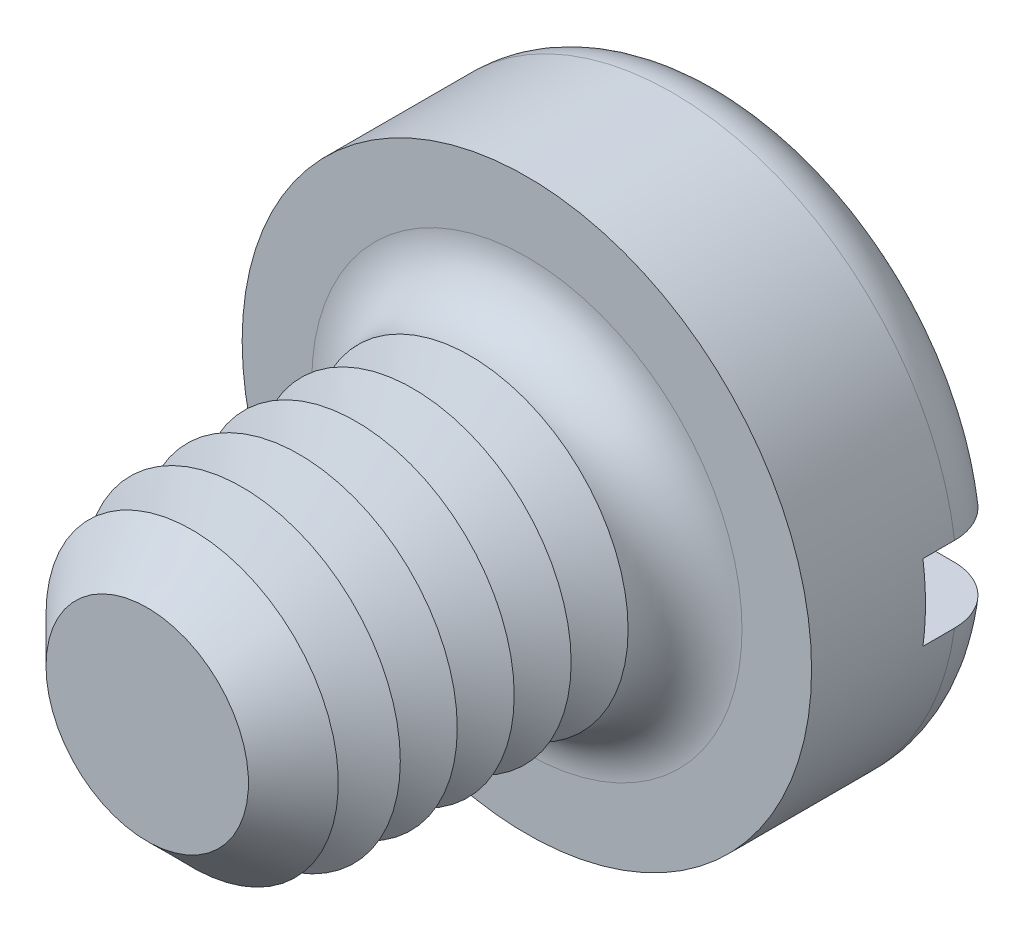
SolidWorks part; units mm, degrees
ref_plane "Front Plane" through (0, 0, 0) normal (0, 0, 1) x (1, 0, 0)
ref_plane "Top Plane" through (0, 0, 0) normal (0, 1, 0) x (1, 0, 0)
ref_plane "Right Plane" through (0, 0, 0) normal (1, 0, 0) x (0, 0, -1)
sketch "Sketch3" plane through (0, 0, 0) normal (0, 0, 1) x (1, 0, 0)
  circle A0 centre (0, 0) radius 2.25
  dimension "D1" = 4.5
extrude "Boss-Extrude2" add sketch "Sketch3" against normal blind 1.6
sketch "Sketch4" plane through (0, 0, 0) normal (0, 0, 1) x (1, 0, 0)
  circle A0 centre (0, 0) radius 1.25
  dimension "D1" = 2.5
extrude "Boss-Extrude3" add sketch "Sketch4" along normal blind 3
fillet "Fillet1" radius 0.45 2 edges at (2.25, 0, -1.6) (1.25, 0, 0)
chamfer "Chamfer1" distance 0.45 angle 45 1 edges at (1.25, 0, 3)
sketch "Sketch5" plane through (0, 0, 0) normal (1, 0, 0) x (0, 0, -1)
  line L0 (1.6944, 0) -> (-7.6738, 0) construction
sketch "Sketch6" plane through (0, 0, 0) normal (1, 0, 0) x (0, 0, -1)
  line L0 (-0.45, 1.25) -> (-0.675, 0.8603)
  line L1 (-0.675, 0.8603) -> (-0.9, 1.25)
  line L2 (-0.45, 1.25) -> (-2.55, 1.25) construction
  line L3 (-0.9, 1.25) -> (-0.45, 1.25)
  dimension "D1" = 0.45
revolve "Cut-Revolve1" cut sketch "Sketch6" angle 360 about L0
pattern_linear "LPattern1" count 5 spacing 0.45 along (0, 0, 1) of "Cut-Revolve1"
sketch "Sketch8" plane through (0, 0, -1.6) normal (0, 0, -1) x (-1, 0, 0)
  line L1 (2.25, -0.3) -> (-2.25, -0.3)
  line L2 (2.25, -0.3) -> (2.25, 0.3)
  line L3 (2.25, 0.3) -> (-2.25, 0.3)
  line L4 (-2.25, -0.3) -> (-2.25, 0.3)
  line L5 (2.25, -0.3) -> (-2.25, 0.3) construction
  line L6 (2.25, 0.3) -> (-2.25, -0.3) construction
  point P0 (0, 0)
  dimension "D1" = 4.5
  dimension "D2" = 0.6
extrude "Cut-Extrude1" cut sketch "Sketch8" against normal blind 0.7
